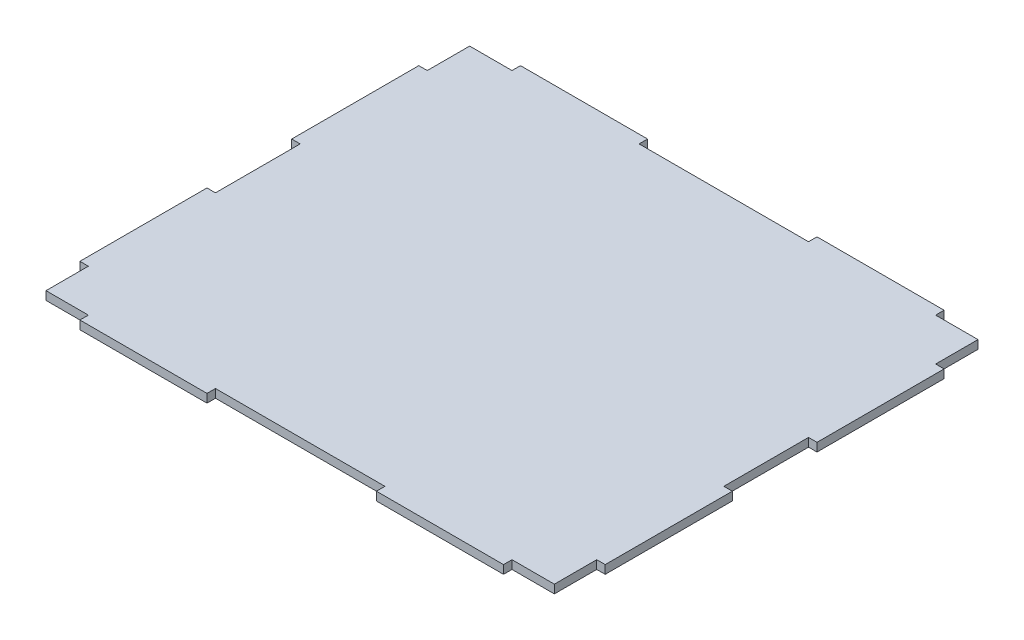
SolidWorks part; units mm, degrees
ref_plane "Alzado" through (0, 0, 0) normal (0, 0, 1) x (1, 0, 0)
ref_plane "Planta" through (0, 0, 0) normal (0, 1, 0) x (1, 0, 0)
ref_plane "Vista lateral" through (0, 0, 0) normal (1, 0, 0) x (0, 0, -1)
sketch "Croquis1" plane through (0, 0, 0) normal (0, 1, 0) x (1, 0, 0)
  line L0 (0, 278.6207) -> (0, 0) construction
  line L1 (-600, -500) -> (-500, -500)
  line L2 (-600, -500) -> (-600, -400)
  line L3 (-600, 500) -> (-500, 500)
  line L4 (600, -500) -> (600, -400)
  line L5 (-600, -500) -> (600, 500) construction
  line L6 (-600, 500) -> (600, -500) construction
  line L7 (-600, 400) -> (-620, 400)
  line L9 (-600, 100) -> (-620, 100)
  line L10 (-620, 400) -> (-620, 100)
  line L11 (-600, -100) -> (-620, -100)
  line L13 (-600, -400) -> (-620, -400)
  line L14 (-620, -100) -> (-620, -400)
  line L15 (0, 0) -> (238.8916, 0) construction
  line L16 (600, -400) -> (620, -400)
  line L18 (-500, 500) -> (-500, 520)
  line L19 (-500, 520) -> (-200, 520)
  line L20 (-200, 500) -> (-200, 520)
  line L22 (200, 500) -> (200, 520)
  line L23 (200, 520) -> (500, 520)
  line L24 (500, 500) -> (500, 520)
  line L25 (620, -100) -> (620, -400)
  line L26 (600, -100) -> (620, -100)
  line L27 (600, 100) -> (620, 100)
  line L28 (620, 400) -> (620, 100)
  line L29 (600, 400) -> (620, 400)
  line L30 (500, -500) -> (500, -520)
  line L31 (-500, -500) -> (-500, -520)
  line L32 (-200, -500) -> (-200, -520)
  line L33 (200, -500) -> (200, -520)
  line L34 (200, -520) -> (500, -520)
  line L35 (-500, -520) -> (-200, -520)
  line L36 (-200, 500) -> (200, 500)
  line L37 (500, 500) -> (600, 500)
  line L38 (600, 400) -> (600, 500)
  line L39 (600, -100) -> (600, 100)
  line L40 (-200, -500) -> (200, -500)
  line L41 (500, -500) -> (600, -500)
  line L42 (-600, 400) -> (-600, 500)
  line L43 (-600, -100) -> (-600, 100)
  point P0 (0, 0)
  dimension "D1" = 1200
  dimension "D2" = 1000
  dimension "D3" = 20
  dimension "D4" = 300
  dimension "D5" = 100
  dimension "D6" = 100
  dimension "D7" = 300
  dimension "D8" = 300
  dimension "D9" = 100
  dimension "D10" = 20
  dimension "D11" = 100
extrude "Saliente-Extruir1" add sketch "Croquis1" along normal blind 20
